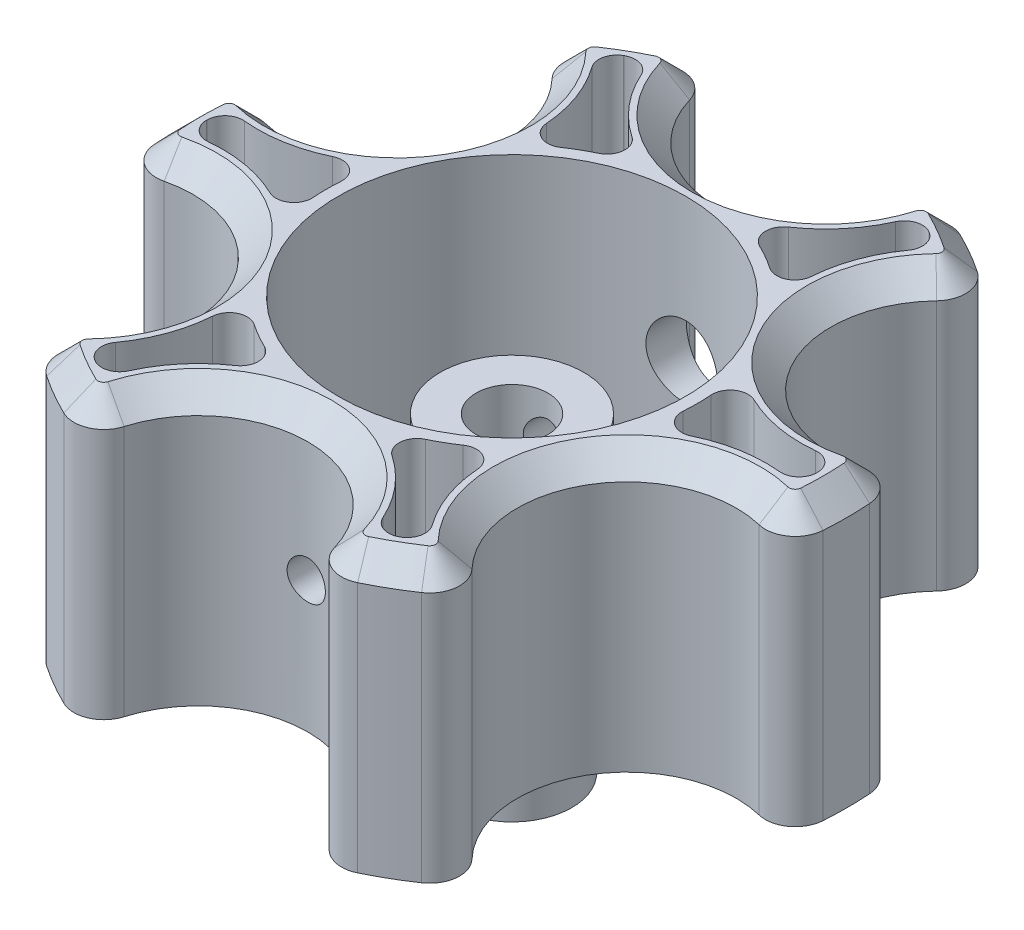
SolidWorks part; units mm, degrees
ref_plane "前视基准面" through (0, 0, 0) normal (0, 0, 1) x (1, 0, 0)
ref_plane "上视基准面" through (0, 0, 0) normal (0, 1, 0) x (1, 0, 0)
ref_plane "右视基准面" through (0, 0, 0) normal (1, 0, 0) x (0, 0, -1)
sketch "草图1" plane through (0, 0, 0) normal (0, 1, 0) x (1, 0, 0)
  line L0 (0, 0) -> (0, 57.3141) construction
  arc A0 (-27.4917, 5.3112) -> (-27.4917, -5.3112) centre (0, 0) ccw
  arc A1 (-9.1462, 26.4641) -> (9.1462, 26.4641) centre (0, 26.2) ccw
  arc A2 (18.3455, 21.1529) -> (27.4917, 5.3112) centre (22.6899, 13.1) ccw
  arc A3 (27.4917, -5.3112) -> (18.3455, -21.1529) centre (22.6899, -13.1) ccw
  arc A4 (9.1462, -26.4641) -> (-9.1462, -26.4641) centre (0, -26.2) ccw
  arc A5 (-18.3455, -21.1529) -> (-27.4917, -5.3112) centre (-22.6899, -13.1) ccw
  arc A6 (-27.4917, 5.3112) -> (-18.3455, 21.1529) centre (-22.6899, 13.1) ccw
  arc A7 (-9.1462, 26.4641) -> (-18.3455, 21.1529) centre (0, 0) ccw
  arc A8 (18.3455, 21.1529) -> (9.1462, 26.4641) centre (0, 0) ccw
  arc A9 (27.4917, -5.3112) -> (27.4917, 5.3112) centre (0, 0) ccw
  arc A10 (9.1462, -26.4641) -> (18.3455, -21.1529) centre (0, 0) ccw
  arc A11 (-18.3455, -21.1529) -> (-9.1462, -26.4641) centre (0, 0) ccw
  point P19 (0, 0)
  dimension "D1" = 56
  dimension "D2" = 18.3
  dimension "D4" = 26.2
  dimension "D3" = 6
extrude "凸台-拉伸1" add sketch "草图1" along normal blind 23
fillet "圆角1" radius 2.5 12 edges at (27.4917, 11.5, 5.3112) (18.3455, 11.5, 21.1529) (9.1462, 11.5, 26.4641) (-27.4917, 11.5, 5.3112) (-27.4917, 11.5, -5.3112) (-18.3455, 11.5, -21.1529) (-9.1462, 11.5, -26.4641) (9.1462, 11.5, -26.4641) (18.3455, 11.5, -21.1529) (27.4917, 11.5, -5.3112) (-18.3455, 11.5, 21.1529) (-9.1462, 11.5, 26.4641)
chamfer "倒角1" distance 2 angle 45 24 edges at (16.7449, 23, 21.4095) (14, 23, 24.2487) (10.1688, 23, 25.2062) (0, 23, 17.05) (-10.1688, 23, 25.2062) (-14, 23, 24.2487) (-16.7449, 23, 21.4095) (-14.7657, 23, 8.525) (-26.9136, 23, 3.7967) (-28, 23, 0) (-26.9136, 23, -3.7967) (-14.7657, 23, -8.525) (-16.7449, 23, -21.4095) (-14, 23, -24.2487) (-10.1688, 23, -25.2062) (0, 23, -17.05) (10.1688, 23, -25.2062) (14, 23, -24.2487) (16.7449, 23, -21.4095) (14.7657, 23, -8.525) (26.9136, 23, -3.7967) (28, 23, 0) (26.9136, 23, 3.7967) (14.7657, 23, 8.525)
sketch "草图2" plane through (0, 23, 0) normal (0, 1, 0) x (1, 0, 0)
  circle A0 centre (0, 0) radius 14.5
  dimension "D1" = 29
extrude "切除-拉伸1" cut sketch "草图2" against normal blind 21
sketch "草图3" plane through (0, 2, 0) normal (0, 1, 0) x (1, 0, 0)
  circle A0 centre (0, 0) radius 3
  circle A1 centre (0, 0) radius 6
  dimension "D1" = 6
  dimension "D2" = 12
extrude "凸台-拉伸2" add sketch "草图3" along normal blind 13.5
sketch "草图4" plane through (0, 0, 0) normal (0, -1, 0) x (1, 0, 0)
  circle A0 centre (0, 0) radius 1.6
  dimension "D1" = 3.2
extrude "切除-拉伸2" cut sketch "草图4" against normal blind 12
sketch "草图5" plane through (0, 0, 0) normal (0, 0, 1) x (1, 0, 0)
  line L0 (0, 79.4842) -> (0, -37.644) construction
  line L1 (-8.7797, 0) -> (8.7797, 0) construction
  circle A0 centre (0, 11) radius 1.25
  dimension "D1" = 11
  dimension "D2" = 2.5
extrude "切除-拉伸3" cut sketch "草图5" against normal mid plane 50
sketch "草图6" plane through (0, 0, 0) normal (0, 0, 1) x (1, 0, 0)
  circle A0 centre (0, 11) radius 3
  dimension "D1" = 6
extrude "切除-拉伸4" cut sketch "草图6" against normal blind 50 from offset 10
sketch "草图7" plane through (0, 0, 0) normal (0, -1, 0) x (1, 0, 0)
  circle A0 centre (0, 0) radius 3
  circle A1 centre (0, 0) radius 5
  dimension "D1" = 6
  dimension "D2" = 10
extrude "凸台-拉伸3" add sketch "草图7" along normal blind 11.5
sketch "草图8" plane through (0, 0, 0) normal (0, -1, 0) x (1, 0, 0)
  circle A0 centre (0, 0) radius 5
  circle A1 centre (0, 0) radius 6
  dimension "D1" = 10
  dimension "D2" = 12
extrude "凸台-拉伸4" add sketch "草图8" along normal blind 1
sketch "草图9" plane through (0, 15.5, 0) normal (0, 1, 0) x (1, 0, 0)
  circle A1 centre (0, 0) radius 6
  circle A2 centre (0, 0) radius 6
  dimension "D1" = 0
extrude "切除-拉伸5" cut sketch "草图9" against normal blind 1
sketch "草图12" plane through (0, 0, 0) normal (0, 0, 1) x (1, 0, 0)
  circle A0 centre (0, 11) radius 1.6
  circle A1 centre (0, 11) radius 1.25 construction
  dimension "D1" = 3.2
extrude "切除-拉伸7" cut sketch "草图12" against normal blind 8
sketch "草图13" plane through (0, 0, 0) normal (0, 0, 1) x (1, 0, 0)
  circle A0 centre (0, 11) radius 1.6
  circle A1 centre (0, 11) radius 1.25 construction
  circle A2 centre (0, 11) radius 1.25 construction
  dimension "D1" = 3.2
extrude "切除-拉伸8" cut sketch "草图13" along normal blind 8 from offset 12
sketch "草图14" plane through (0, 23, 0) normal (0, 1, 0) x (1, 0, 0)
  arc A0 (11.1785, -22.9192) -> (14.2594, -21.1405) centre (0, 0) ccw
  arc A1 (14.2594, -21.1405) -> (14.2594, -21.1405) centre (14.2594, -21.1405) ccw
  arc A2 (25.4379, -1.7787) -> (14.2594, -21.1405) centre (22.6899, -13.1) ccw
  arc A3 (25.4379, -1.7787) -> (25.4379, -1.7787) centre (25.4379, -1.7787) ccw
  arc A4 (25.4379, -1.7787) -> (25.4379, 1.7787) centre (0, 0) ccw
  arc A5 (25.4379, 1.7787) -> (25.4379, 1.7787) centre (25.4379, 1.7787) ccw
  arc A6 (14.2594, 21.1405) -> (25.4379, 1.7787) centre (22.6899, 13.1) ccw
  arc A7 (14.2594, 21.1405) -> (14.2594, 21.1405) centre (14.2594, 21.1405) ccw
  arc A8 (14.2594, 21.1405) -> (11.1785, 22.9192) centre (0, 0) ccw
  arc A9 (11.1785, 22.9192) -> (11.1785, 22.9192) centre (11.1785, 22.9192) ccw
  arc A10 (-11.1785, 22.9192) -> (11.1785, 22.9192) centre (0, 26.2) ccw
  arc A11 (-11.1785, 22.9192) -> (-11.1785, 22.9192) centre (-11.1785, 22.9192) ccw
  arc A12 (-11.1785, 22.9192) -> (-14.2594, 21.1405) centre (0, 0) ccw
  arc A13 (-14.2594, 21.1405) -> (-14.2594, 21.1405) centre (-14.2594, 21.1405) ccw
  arc A14 (-25.4379, 1.7787) -> (-14.2594, 21.1405) centre (-22.6899, 13.1) ccw
  arc A15 (-25.4379, 1.7787) -> (-25.4379, 1.7787) centre (-25.4379, 1.7787) ccw
  arc A16 (-25.4379, 1.7787) -> (-25.4379, -1.7787) centre (0, 0) ccw
  arc A17 (-25.4379, -1.7787) -> (-25.4379, -1.7787) centre (-25.4379, -1.7787) ccw
  arc A18 (-14.2594, -21.1405) -> (-25.4379, -1.7787) centre (-22.6899, -13.1) ccw
  arc A19 (-14.2594, -21.1405) -> (-14.2594, -21.1405) centre (-14.2594, -21.1405) ccw
  arc A20 (-14.2594, -21.1405) -> (-11.1785, -22.9192) centre (0, 0) ccw
  arc A21 (-11.1785, -22.9192) -> (-11.1785, -22.9192) centre (-11.1785, -22.9192) ccw
  arc A22 (11.1785, -22.9192) -> (-11.1785, -22.9192) centre (0, -26.2) ccw
  arc A23 (11.1785, -22.9192) -> (11.1785, -22.9192) centre (11.1785, -22.9192) ccw
  arc A24 (11.3977, -23.3686) -> (14.539, -21.555) centre (0, 0) ccw
  arc A25 (14.539, -21.555) -> (14.6212, -20.7954) centre (14.2594, -21.1405) ccw
  arc A26 (25.3199, -2.2646) -> (14.6212, -20.7954) centre (22.6899, -13.1) ccw
  arc A27 (25.3199, -2.2646) -> (25.9367, -1.8136) centre (25.4379, -1.7787) ccw
  arc A28 (25.9367, -1.8136) -> (25.9367, 1.8136) centre (0, 0) ccw
  arc A29 (25.9367, 1.8136) -> (25.3199, 2.2646) centre (25.4379, 1.7787) ccw
  arc A30 (14.6212, 20.7954) -> (25.3199, 2.2646) centre (22.6899, 13.1) ccw
  arc A31 (14.6212, 20.7954) -> (14.539, 21.555) centre (14.2594, 21.1405) ccw
  arc A32 (14.539, 21.555) -> (11.3977, 23.3686) centre (0, 0) ccw
  arc A33 (11.3977, 23.3686) -> (10.6987, 23.06) centre (11.1785, 22.9192) ccw
  arc A34 (-10.6987, 23.06) -> (10.6987, 23.06) centre (0, 26.2) ccw
  arc A35 (-10.6987, 23.06) -> (-11.3977, 23.3686) centre (-11.1785, 22.9192) ccw
  arc A36 (-11.3977, 23.3686) -> (-14.539, 21.555) centre (0, 0) ccw
  arc A37 (-14.539, 21.555) -> (-14.6212, 20.7954) centre (-14.2594, 21.1405) ccw
  arc A38 (-25.3199, 2.2646) -> (-14.6212, 20.7954) centre (-22.6899, 13.1) ccw
  arc A39 (-25.3199, 2.2646) -> (-25.9367, 1.8136) centre (-25.4379, 1.7787) ccw
  arc A40 (-25.9367, 1.8136) -> (-25.9367, -1.8136) centre (0, 0) ccw
  arc A41 (-25.9367, -1.8136) -> (-25.3199, -2.2646) centre (-25.4379, -1.7787) ccw
  arc A42 (-14.6212, -20.7954) -> (-25.3199, -2.2646) centre (-22.6899, -13.1) ccw
  arc A43 (-14.6212, -20.7954) -> (-14.539, -21.555) centre (-14.2594, -21.1405) ccw
  arc A44 (-14.539, -21.555) -> (-11.3977, -23.3686) centre (0, 0) ccw
  arc A45 (-11.3977, -23.3686) -> (-10.6987, -23.06) centre (-11.1785, -22.9192) ccw
  arc A46 (10.6987, -23.06) -> (-10.6987, -23.06) centre (0, -26.2) ccw
  arc A47 (10.6987, -23.06) -> (11.3977, -23.3686) centre (11.1785, -22.9192) ccw
  arc A48 (11.3977, -23.3686) -> (14.539, -21.555) centre (0, 0) ccw
  arc A49 (14.539, -21.555) -> (14.6212, -20.7954) centre (14.2594, -21.1405) ccw
  arc A50 (25.3199, -2.2646) -> (14.6212, -20.7954) centre (22.6899, -13.1) ccw
  arc A51 (25.3199, -2.2646) -> (25.9367, -1.8136) centre (25.4379, -1.7787) ccw
  arc A52 (25.9367, -1.8136) -> (25.9367, 1.8136) centre (0, 0) ccw
  arc A53 (25.9367, 1.8136) -> (25.3199, 2.2646) centre (25.4379, 1.7787) ccw
  arc A54 (14.6212, 20.7954) -> (25.3199, 2.2646) centre (22.6899, 13.1) ccw
  arc A55 (14.6212, 20.7954) -> (14.539, 21.555) centre (14.2594, 21.1405) ccw
  arc A56 (14.539, 21.555) -> (11.3977, 23.3686) centre (0, 0) ccw
  arc A57 (11.3977, 23.3686) -> (10.6987, 23.06) centre (11.1785, 22.9192) ccw
  arc A58 (-10.6987, 23.06) -> (10.6987, 23.06) centre (0, 26.2) ccw
  arc A59 (-10.6987, 23.06) -> (-11.3977, 23.3686) centre (-11.1785, 22.9192) ccw
  arc A60 (-11.3977, 23.3686) -> (-14.539, 21.555) centre (0, 0) ccw
  arc A61 (-14.539, 21.555) -> (-14.6212, 20.7954) centre (-14.2594, 21.1405) ccw
  arc A62 (-25.3199, 2.2646) -> (-14.6212, 20.7954) centre (-22.6899, 13.1) ccw
  arc A63 (-25.3199, 2.2646) -> (-25.9367, 1.8136) centre (-25.4379, 1.7787) ccw
  arc A64 (-25.9367, 1.8136) -> (-25.9367, -1.8136) centre (0, 0) ccw
  arc A65 (-25.9367, -1.8136) -> (-25.3199, -2.2646) centre (-25.4379, -1.7787) ccw
  arc A66 (-14.6212, -20.7954) -> (-25.3199, -2.2646) centre (-22.6899, -13.1) ccw
  arc A67 (-14.6212, -20.7954) -> (-14.539, -21.555) centre (-14.2594, -21.1405) ccw
  arc A68 (-14.539, -21.555) -> (-11.3977, -23.3686) centre (0, 0) ccw
  arc A69 (-11.3977, -23.3686) -> (-10.6987, -23.06) centre (-11.1785, -22.9192) ccw
  arc A70 (10.6987, -23.06) -> (-10.6987, -23.06) centre (0, -26.2) ccw
  arc A71 (10.6987, -23.06) -> (11.3977, -23.3686) centre (11.1785, -22.9192) ccw
  circle A72 centre (0, 0) radius 15.5
  circle A73 centre (0, 0) radius 14.5 construction
  dimension "D2" = 0.5
  dimension "D3" = 1
  dimension "D1" = 0
extrude "切除-拉伸9" cut sketch "草图14" against normal offset from surface (21.5 mm away) 1.5 contours A72 A2 A4 A6 | A72 A6 A8 A10 | A72 A10 A12 A14 | A72 A14 A16 A18 | A72 A18 A20 A22 | A72 A22 A0 A2
fillet "圆角4" radius 1.5 24 edges at (11.1785, 12.25, -22.9192) (3.5209, 12.25, -15.0948) (-3.5209, 12.25, -15.0948) (14.833, 12.25, -4.4982) (11.312, 12.25, -10.5966) (14.2594, 12.25, -21.1405) (-14.2594, 12.25, -21.1405) (-11.312, 12.25, -10.5966) (-14.833, 12.25, -4.4982) (-11.1785, 12.25, -22.9192) (-25.4379, 12.25, 1.7787) (-14.833, 12.25, 4.4982) (-11.312, 12.25, 10.5966) (-25.4379, 12.25, -1.7787) (-11.1785, 12.25, 22.9192) (-3.5209, 12.25, 15.0948) (3.5209, 12.25, 15.0948) (-14.2594, 12.25, 21.1405) (14.2594, 12.25, 21.1405) (14.833, 12.25, 4.4982) (11.312, 12.25, 10.5966) (11.1785, 12.25, 22.9192) (25.4379, 12.25, -1.7787) (25.4379, 12.25, 1.7787)
